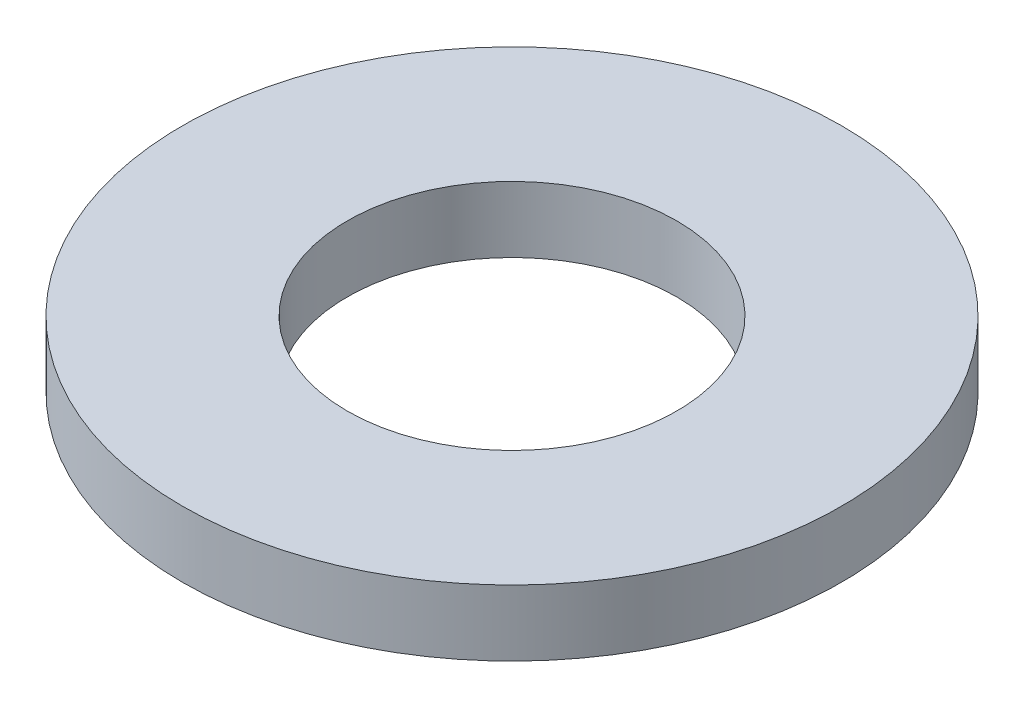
SolidWorks part; units mm, degrees
ref_plane "Front Plane" through (0, 0, 0) normal (0, 0, 1) x (1, 0, 0)
ref_plane "Top Plane" through (0, 0, 0) normal (0, 1, 0) x (1, 0, 0)
ref_plane "Right Plane" through (0, 0, 0) normal (1, 0, 0) x (0, 0, -1)
sketch "Sketch1" plane through (0, 0, 0) normal (0, 1, 0) x (1, 0, 0)
  circle A1 centre (0, 0) radius 6.35
  circle A2 centre (0, 0) radius 3.175
  dimension "D1" = 12.7
extrude "Boss-Extrude1" add sketch "Sketch1" along normal blind 1.27
